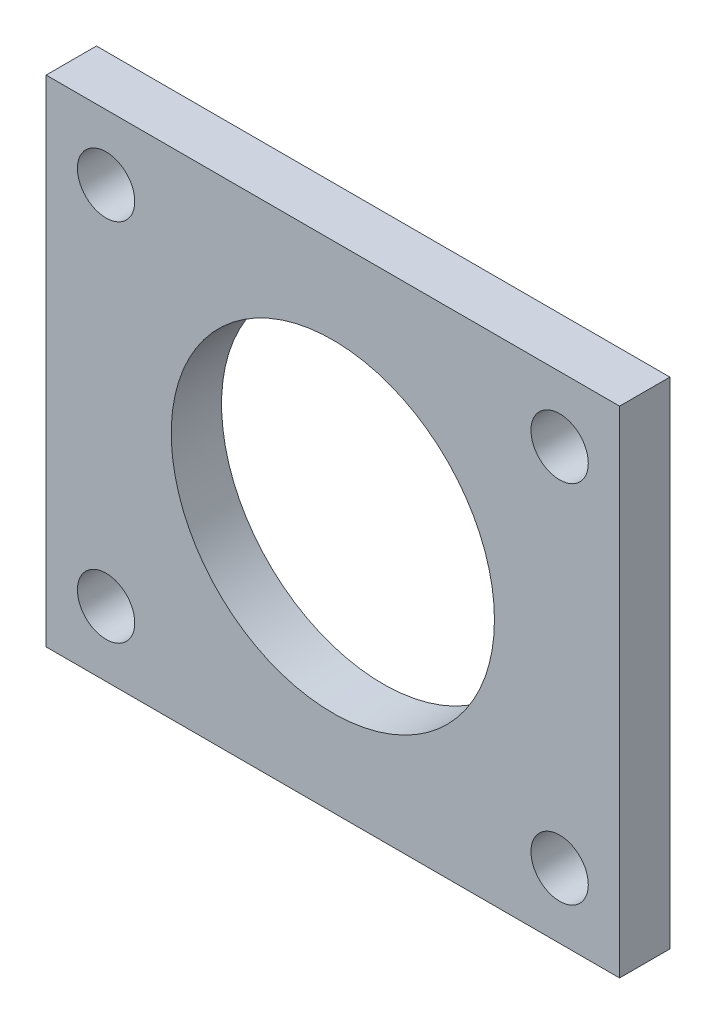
SolidWorks part; units mm, degrees
ref_plane "Front Plane" through (0, 0, 0) normal (0, 0, 1) x (1, 0, 0)
ref_plane "Top Plane" through (0, 0, 0) normal (0, 1, 0) x (1, 0, 0)
ref_plane "Right Plane" through (0, 0, 0) normal (1, 0, 0) x (0, 0, -1)
sketch "Sketch1" plane through (0, 0, 0) normal (0, 0, 1) x (1, 0, 0)
  line L1 (55, -47.5) -> (-55, -47.5)
  line L2 (55, -47.5) -> (55, 47.5)
  line L3 (55, 47.5) -> (-55, 47.5)
  line L4 (-55, -47.5) -> (-55, 47.5)
  line L5 (55, -47.5) -> (-55, 47.5) construction
  line L6 (55, 47.5) -> (-55, -47.5) construction
  line L7 (43.5, -35) -> (-43.5, -35) construction
  line L8 (43.5, -35) -> (43.5, 35) construction
  line L9 (43.5, 35) -> (-43.5, 35) construction
  line L10 (-43.5, -35) -> (-43.5, 35) construction
  line L11 (43.5, -35) -> (-43.5, 35) construction
  line L12 (43.5, 35) -> (-43.5, -35) construction
  circle A0 centre (0, 0) radius 31
  circle A1 centre (-43.5, 35) radius 5.5
  circle A2 centre (43.5, 35) radius 5.5
  circle A3 centre (43.5, -35) radius 5.5
  circle A4 centre (-43.5, -35) radius 5.5
  point P0 (0, 0)
  dimension "D3" = 62
  dimension "D6" = 11
  dimension "D1" = 95
  dimension "D2" = 110
  dimension "D4" = 87
  dimension "D5" = 70
extrude "Boss-Extrude1" add sketch "Sketch1" along normal blind 9.65
